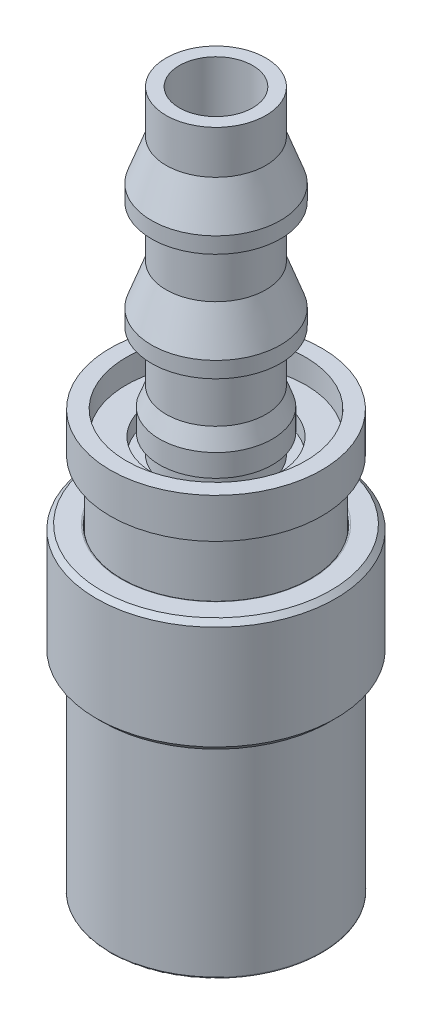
SolidWorks part; units mm, degrees
other "Body"
ref_plane "Front Plane" through (0, 0, 0) normal (0, 0, 1) x (1, 0, 0)
ref_plane "Top Plane" through (0, 0, 0) normal (0, 1, 0) x (1, 0, 0)
ref_plane "Right Plane" through (0, 0, 0) normal (1, 0, 0) x (0, 0, -1)
imported_body "SC200-S"
imported_body "Sleeve"
imported_body "Barb"
imported_body "PL-Barb"
sketch "Sketch1" plane through (0, 0, 0) normal (0, 0, 1) x (1, 0, 0)
  line L0 (-4.7752, 8.1191) -> (-3.175, 7.1952)
  line L1 (-3.175, 7.1952) -> (-3.175, 2.3876)
  line L2 (-3.175, 2.3876) -> (-4.7752, 0.7874)
  line L3 (-4.7752, 0.7874) -> (-4.7752, 8.1191)
  line L4 (-4.7752, 8.1191) -> (-4.7752, 0.7874) construction
  line L5 (-5.0546, 8.2804) -> (-4.7752, 8.1191) construction
  line L6 (-4.7752, 0.7874) -> (-5.5626, 0) construction
  line L7 (0, -1.1164) -> (0, 5.9749) construction
  line L8 (0, 8.1191) -> (0, 0.7874) construction
  dimension "D1" = 6.35
revolve "Revolve1" add sketch "Sketch1" angle 360 about L7
sketch "Sketch2" plane through (0, 0, 0) normal (0, -1, 0) x (1, 0, 0)
  line L1 (0, 5.2793) -> (-4.572, 2.6396)
  line L2 (-4.572, 2.6396) -> (-4.572, -2.6396)
  line L3 (-4.572, -2.6396) -> (0, -5.2793)
  line L4 (0, -5.2793) -> (4.572, -2.6396)
  line L5 (4.572, -2.6396) -> (4.572, 2.6396)
  line L6 (4.572, 2.6396) -> (0, 5.2793)
  circle A0 centre (0, 0) radius 4.572 construction
  dimension "D1" = 9.144
extrude "Cut-Extrude1" cut sketch "Sketch2" against normal up to surface (9.3379 mm away)
